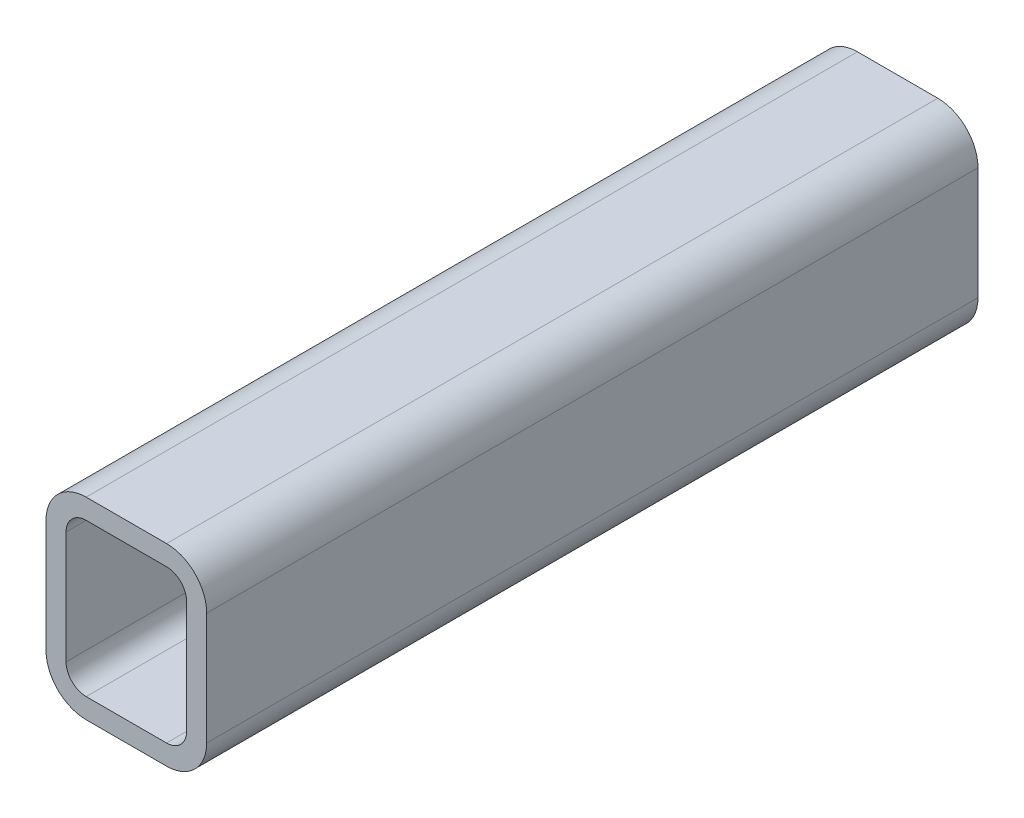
SolidWorks part; units mm, degrees
ref_plane "Front Plane" through (0, 0, 0) normal (0, 0, 1) x (1, 0, 0)
ref_plane "Top Plane" through (0, 0, 0) normal (0, 1, 0) x (1, 0, 0)
ref_plane "Right Plane" through (0, 0, 0) normal (1, 0, 0) x (0, 0, -1)
sketch "Sketch1" plane through (0, 0, 0) normal (0, 0, 1) x (1, 0, 0)
sketch_block_instance "HSS3x2.5x0.3125-1"
sketch_block "HSS3x2.5x0.3125"
extrude "Boss-Extrude1" add sketch "Sketch1" along normal blind 304.8
